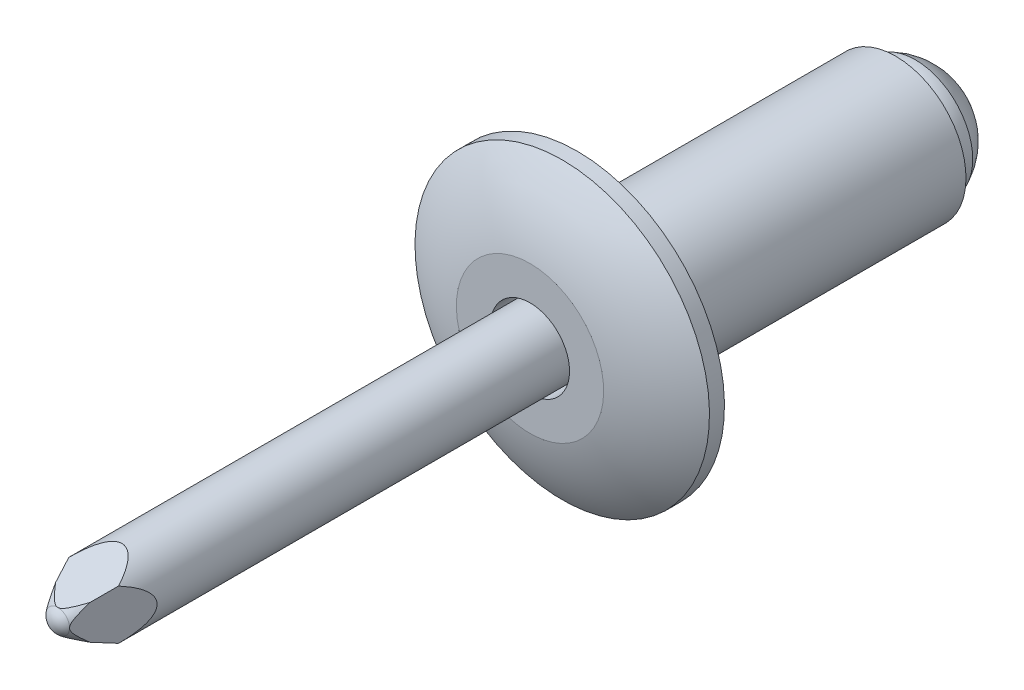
SolidWorks part; units mm, degrees
ref_plane "Front" through (0, 0, 0) normal (0, 0, 1) x (1, 0, 0)
ref_plane "Top" through (0, 0, 0) normal (0, 1, 0) x (1, 0, 0)
ref_plane "Right" through (0, 0, 0) normal (1, 0, 0) x (0, 0, -1)
sketch "Sketch1" plane through (0, 0, 0) normal (1, 0, 0) x (0, 0, -1)
  line L0 (-17.7927, 0) -> (-1.6002, 0) construction
  line L1 (-1.6002, 0) -> (0, 0) construction
  line L2 (0, 0) -> (10.795, 0) construction
  line L3 (10.795, 0) -> (13.1953, 0) construction
  line L8 (0, 4.9911) -> (0, -4.9911) construction
  line L9 (10.795, 2.3813) -> (10.795, -2.3813) construction
sketch "Sketch2" plane through (0, 0, 0) normal (1, 0, 0) x (0, 0, -1)
  line L0 (-17.7927, 1.1906) -> (-17.7927, 0) construction
  line L1 (-17.7927, 1.1906) -> (0, 1.1906) construction
  line L2 (0, 4.9911) -> (0, -4.9911) construction
  line L3 (0, 0) -> (0, 4.9911) construction
  line L4 (-1.6002, 0) -> (-1.6002, -1.8472) construction
  line L5 (10.795, 2.3813) -> (0, 2.3812)
  line L6 (10.795, 2.3813) -> (10.795, 0) construction
  line L7 (13.1953, 0) -> (13.1953, 2.3813) construction
  line L8 (10.795, 2.3813) -> (10.795, 0)
  line L9 (13.1953, 2.3813) -> (10.795, 2.3813) construction
  line L10 (-1.6002, 1.3395) -> (-1.6002, 2.4955)
  line L11 (10.795, 0) -> (13.1953, 0) construction
  line L12 (10.795, 0) -> (1.0795, 0)
  line L13 (-1.6002, 1.1906) -> (-1.6002, 0) construction
  line L14 (10.795, 2.3813) -> (10.795, 0) construction
  line L15 (10.795, 2.3813) -> (10.795, 0) construction
  line L16 (10.795, 0) -> (10.795, 2.3813) construction
  line L17 (10.795, 2.3813) -> (10.795, 0) construction
  line L18 (10.795, 0) -> (10.795, 2.3813) construction
  line L19 (0, 2.3812) -> (0, 4.9911)
  line L20 (-1.6002, 1.3395) -> (0, 1.3395)
  line L21 (-17.7927, 1.3395) -> (0, 1.3395) construction
  line L22 (0, 4.9911) -> (-0.508, 4.9911)
  line L23 (0, 1.3395) -> (1.0795, 1.3395)
  line L24 (1.0795, 1.3395) -> (1.0795, 0)
  arc A0 (13.1953, 0) -> (10.795, 1.905) centre (11.2392, 0) ccw construction
  arc A2 (-0.508, 4.9911) -> (-1.6002, 2.4955) centre (4.7785, 1.1906) ccw
revolve "Revolve1" add sketch "Sketch2" angle 360 about L12
sketch "Sketch7" plane through (0, 0, 0) normal (1, 0, 0) x (0, 0, -1)
  line L0 (-16.6632, 1.1906) -> (1.0795, 1.1906)
  line L1 (1.0795, 1.3395) -> (1.0795, 0) construction
  line L2 (1.0795, 1.1906) -> (1.0795, 0)
  line L3 (1.0795, 0) -> (-17.7927, 0)
  line L5 (-17.6066, 0.399) -> (-16.6632, 1.1906)
  arc A0 (-17.7927, 0) -> (-17.6066, 0.399) centre (-17.2718, 0) cw
revolve "Revolve2" add sketch "Sketch7" angle 360 about L0
sketch "Sketch8" plane through (0, 0, 0) normal (1, 0, 0) x (0, 0, -1)
  line L1 (10.795, 1.905) -> (10.795, 0)
  line L2 (10.795, 0) -> (13.1953, 0) construction
  line L3 (13.1953, 0) -> (11.2392, 0) construction
  line L4 (12.7063, 0) -> (10.795, 0)
  line L5 (10.795, 1.905) -> (11.4613, 1.905) construction
  arc A0 (13.1953, 0) -> (10.795, 1.905) centre (11.2392, 0) ccw construction
  arc A1 (11.4613, 1.9435) -> (10.795, 1.905) centre (11.2392, 0) ccw
  arc A2 (11.4613, 1.9435) -> (12.7063, 0) centre (10.5669, 0) cw
  circle A3 centre (11.2392, 0) radius 1.9561 construction
  point P7 (12.7063, 0)
  point P8 (12.2172, 0)
  point P9 (11.7282, 0)
  point P12 (11.0171, 1.905)
  point P13 (11.2392, 1.905)
revolve "Revolve3" add sketch "Sketch8" angle 360 about L3
sketch "Sketch3" plane through (0, 0, 0) normal (0, 1, 0) x (1, 0, 0)
  line L0 (-1.3938, -14.8735) -> (-0.3313, -17.7927)
  line L1 (-0.3313, -17.7927) -> (0.3313, -17.7927)
  line L3 (0, -17.7927) -> (0, -18.3007) construction
  line L4 (0.399, -17.6066) -> (-0.399, -17.6066) construction
  line L5 (-1.3938, -14.8735) -> (-1.3938, -18.3007)
  line L6 (-1.3938, -18.3007) -> (1.3938, -18.3007)
  line L7 (1.3938, -18.3007) -> (1.3938, -14.8735)
  line L8 (-1.1906, 1.0795) -> (-1.1906, -16.6632) construction
  line L9 (0, -17.7927) -> (0, -1.6002) construction
  line L10 (0.3313, -17.7927) -> (1.3938, -14.8735)
  line L11 (-1.1906, -16.6632) -> (-0.399, -17.6066) construction
  arc A0 (-0.399, -17.6066) -> (0.399, -17.6066) centre (0, -17.2718) ccw construction
  point P11 (-0.399, -17.6066)
  point P25 (0, -17.7927)
  dimension "D1" = 40
  dimension "D2" = 0.2032
  dimension "D3" = 0.508
extrude "Cut-Extrude1" cut sketch "Sketch3" against normal through all both and the other way through all
pattern_circular "CirPattern1" count 2 every 90 about axis through (0, 0, 17.7927) along (0, 0, -1) of "Cut-Extrude1"
sketch "Sketch9" plane through (0, 0, 0) normal (0, 1, 0) x (1, 0, 0)
  line L0 (0, -17.7927) -> (0, 19.9517) construction
  line L1 (0, 10.795) -> (0, 13.1953) construction
  line L2 (4.9911, 0) -> (-4.9911, 0) construction
  line L3 (3.0534, 0) -> (3.2011, 0)
  line L4 (3.0534, 0) -> (3.0534, 0.0254)
  line L5 (3.0534, 0.0254) -> (3.2011, 0.0254)
  line L6 (3.2011, 0) -> (3.2011, 0.0254)
  line L8 (3.4621, 0) -> (3.6098, 0)
  line L9 (3.4621, 0) -> (3.4621, 0.0254)
  line L10 (3.4621, 0.0254) -> (3.6098, 0.0254)
  line L11 (3.6098, 0) -> (3.6098, 0.0254)
  line L12 (3.8265, 0) -> (3.9742, 0)
  line L13 (3.8265, 0) -> (3.8265, 0.0254)
  line L14 (3.8265, 0.0254) -> (3.9742, 0.0254)
  line L15 (3.9742, 0) -> (3.9742, 0.0254)
  line L16 (4.3534, 0) -> (4.5011, 0)
  line L17 (4.3534, 0) -> (4.3534, 0.0254)
  line L18 (4.3534, 0.0254) -> (4.5011, 0.0254)
  line L19 (4.5011, 0) -> (4.5011, 0.0254)
  line L20 (2.8614, 0) -> (2.7136, 0)
  line L21 (2.8614, 0) -> (2.8614, 0.0254)
  line L22 (2.8614, 0.0254) -> (2.7136, 0.0254)
  line L23 (2.7136, 0) -> (2.7136, 0.0254)
  point P24 (4.4273, 0.0254)
  point P25 (3.9004, 0.0254)
  point P26 (3.536, 0.0254)
  point P27 (3.1273, 0.0254)
  point P32 (2.7875, 0.0254)
revolve "Revolve4" add sketch "Sketch9" angle 360 about L0
equation "\"D5@Sketch1\" = \"Head Height@Sketch1\" * 1.5"
equation "\"D9@Sketch1\" = \"Length@Sketch1\" * 1.5"
equation "\"D1@Sketch2\"=\"Diameter@Sketch1\"/4"
equation "\"D4@Sketch2\"=\"D1@Sketch2\"/8"
equation "\"D2@Sketch2\"=\"Length@Sketch1\"/10"
equation "\"D5@Sketch2\"=\"Diameter@Sketch1\"*.8/2"
equation "\"D1@Sketch7\"=(\"D1@Sketch2\"-\"D4@Sketch2\")*2*.25"
equation "\"D6@Sketch2\"=\"Head Diameter@Sketch1\"/2*.5"
equation "\"D7@Sketch9\"=.15566*(\"Head Diameter@Sketch1\"-\"Diameter@Sketch1\")+\"Diameter@Sketch1\""
equation "\"D3@Sketch9\"=.7839623*(\"Head Diameter@Sketch1\"-\"Diameter@Sketch1\")+\"Diameter@Sketch1\""
equation "\"D1@Sketch9\"=.028302*(\"Head Diameter@Sketch1\"-\"Diameter@Sketch1\")"
equation "\"D6@Sketch9\"=.285849*(\"Head Diameter@Sketch1\"-\"Diameter@Sketch1\")+\"Diameter@Sketch1\""
equation "\"D5@Sketch9\"=.4424528*(\"Head Diameter@Sketch1\"-\"Diameter@Sketch1\")+\"Diameter@Sketch1\""
equation "\"D4@Sketch9\"=.582075*(\"Head Diameter@Sketch1\"-\"Diameter@Sketch1\")+\"Diameter@Sketch1\""
